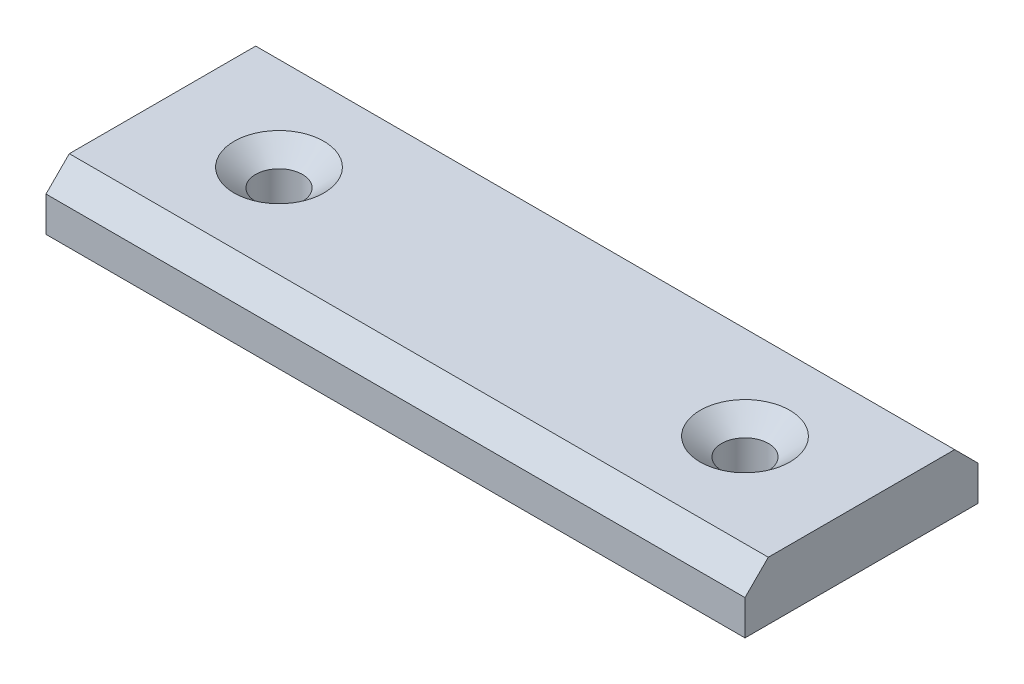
SolidWorks part; units mm, degrees
ref_plane "Front Plane" through (0, 0, 0) normal (0, 0, 1) x (1, 0, 0)
ref_plane "Top Plane" through (0, 0, 0) normal (0, 1, 0) x (1, 0, 0)
ref_plane "Right Plane" through (0, 0, 0) normal (1, 0, 0) x (0, 0, -1)
sketch "Sketch1" plane through (0, 0, 0) normal (0, 1, 0) x (1, 0, 0)
  line L1 (-36.3342, 42.49) -> (39.8658, 42.49)
  line L2 (-36.3342, 42.49) -> (-36.3342, 17.09)
  line L3 (-36.3342, 17.09) -> (39.8658, 17.09)
  line L4 (39.8658, 42.49) -> (39.8658, 17.09)
  dimension "D1" = 25.4
  dimension "D2" = 76.2
extrude "Extrude1" add sketch "Sketch1" along normal blind 6.35
hole_wizard "CSK for #10 Flat Head Machine Screw (100)1" positions "3DSketch1" profile "Sketch2" countersink size "#10" standard "Ansi Inch"
sketch3d "3DSketch1"
  line L0 (-36.3342, 6.35, -42.49) -> (-36.3342, 6.35, -17.09) construction
  line L2 (39.8658, 6.35, -42.49) -> (-36.3342, 6.35, -42.49) construction
  point P0 (-23.6342, 6.35, -29.79)
  point P4 (27.1658, 6.35, -29.79)
  dimension "D1" = 12.7
  dimension "D2" = 50.8
  dimension "D5" = 12.7
  dimension "D7" = 12.7
sketch "Sketch2" plane through (-23.6342, 6.35, -29.79) normal (1, 0, 0) x (0, 0, 1)
  line L0 (0, 0) -> (0, 6.35)
  line L1 (0, 6.35) -> (2.5527, 6.35)
  line L2 (2.5527, 6.35) -> (2.5527, 1.9608)
  line L3 (2.5527, 1.9608) -> (4.8895, 0)
  line L5 (4.8895, 0) -> (0, 0)
  line L6 (-2.5527, 1.9608) -> (-4.8895, 0) construction
  line L11 (0, -6.35) -> (0, 107.95) construction
  dimension "Thru Hole Dia." = 5.1054
  dimension "Thru Hole Depth" = 6.35
  dimension "Near C'Sink Dia." = 9.779
  dimension "Near C'Sink Angle" = 100
chamfer "Chamfer1" distance 2.54 angle 45 2 edges at (1.7658, 6.35, -42.49) (1.7658, 6.35, -17.09)
